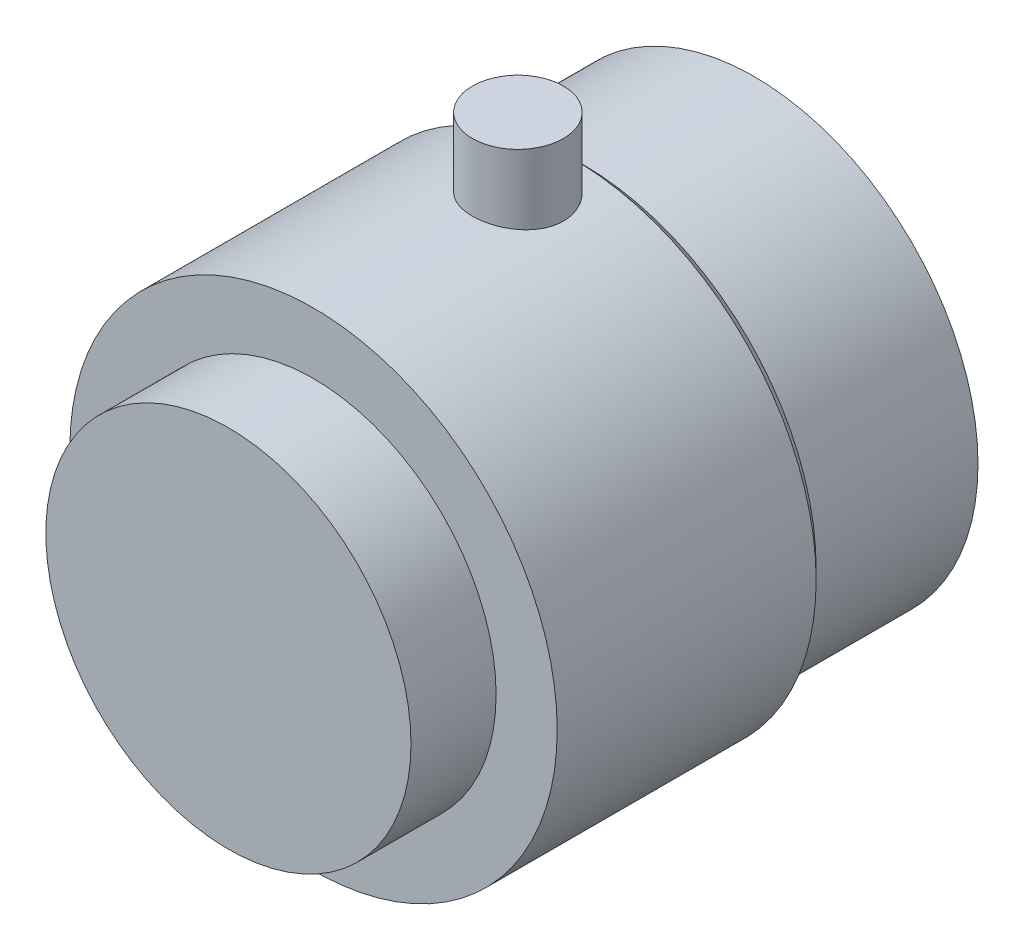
SolidWorks part; units mm, degrees
ref_plane "Front Plane" through (0, 0, 0) normal (0, 0, 1) x (1, 0, 0)
ref_plane "Top Plane" through (0, 0, 0) normal (0, 1, 0) x (1, 0, 0)
ref_plane "Right Plane" through (0, 0, 0) normal (1, 0, 0) x (0, 0, -1)
sketch "Sketch1" plane through (0, 0, 0) normal (0, 0, 1) x (1, 0, 0)
  circle A0 centre (0, 0) radius 15.621
extrude "Extrude1" add sketch "Sketch1" along normal blind 11.938
sketch "Sketch2" plane through (0, 0, 11.938) normal (0, 0, 1) x (1, 0, 0)
  circle A0 centre (0, 0) radius 17.018
extrude "Extrude2" add sketch "Sketch2" along normal blind 18.8468
sketch "Sketch3" plane through (0, 0, 30.7848) normal (0, 0, 1) x (1, 0, 0)
  circle A0 centre (0, 0) radius 12.7508
extrude "Extrude3" add sketch "Sketch3" along normal blind 5.9436
sketch "Sketch4" plane through (0, 0, 0) normal (0, 1, 0) x (1, 0, 0)
  circle A0 centre (0, -16.51) radius 3.175
  dimension "D1" = 16.51
extrude "Extrude4" add sketch "Sketch4" along normal blind 21.717
chamfer "Chamfer1" distance 0.762 angle 45 1 edges at (17.018, 0, 11.938)
